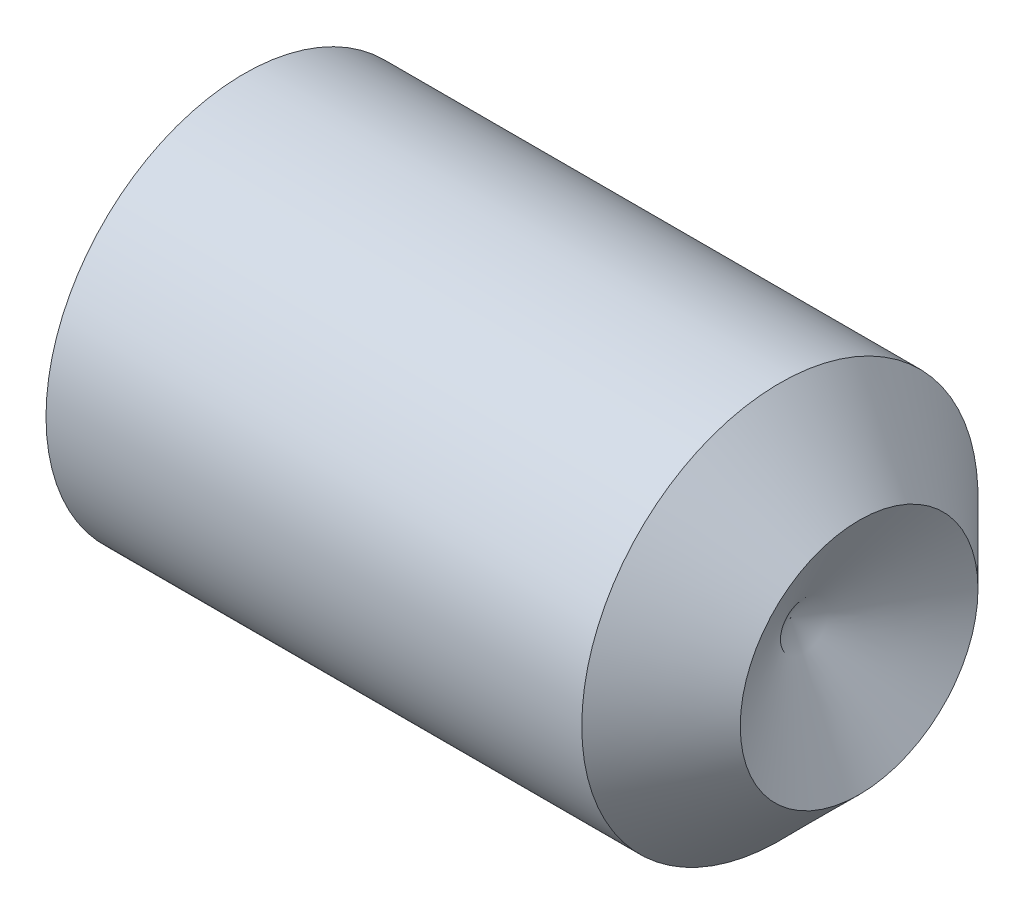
SolidWorks part; units mm, degrees
ref_plane "Plane1" through (0, 0, 0) normal (0, 0, 1) x (1, 0, 0)
ref_plane "Plane2" through (0, 0, 0) normal (0, 1, 0) x (1, 0, 0)
ref_plane "Plane3" through (0, 0, 0) normal (1, 0, 0) x (0, 0, -1)
revolve "BaseBody" add sketch "BodySke" angle 360 about L5
sketch "BodySke" plane through (0, 0, 0) normal (0, 0, 1) x (1, 0, 0)
  line L0 (0, 0) -> (0, 4.172)
  line L1 (0, 4.172) -> (0.478, 5)
  line L2 (0.478, 5) -> (14, 5)
  line L3 (14, 5) -> (16, 3)
  line L4 (14.2679, 0) -> (0, 0)
  line L5 (-12.7, 0) -> (88.9, 0) construction
  line L6 (14.2679, 0) -> (16, 3)
  line L7 (16, 3) -> (16, 12.525) construction
  line L8 (0, -4.172) -> (0.478, -5) construction
  line L9 (14.2679, 0) -> (16, -3) construction
  line L10 (14, -5) -> (16, -3) construction
  line L11 (0.75, 15.875) -> (0.75, -3.175) construction
  dimension "Length" = 16
  dimension "Diameter" = 10
  dimension "Drive_ch_ang" = 60
  dimension "Minor_dia" = 8.344
  dimension "Cup_nose_ang" = 45
  dimension "Cup_ang" = 120
  dimension "Cup_dia" = 6
  dimension "Advance" = 1.5
sketch "Sketch2" plane through (0, 0, 0) normal (-1, 0, 0) x (0, 0, 1)
  line L0 (1.4434, 2.5) -> (-1.4434, 2.5)
  line L1 (-1.4434, 2.5) -> (-2.8868, 0)
  line L2 (1.4434, 2.5) -> (2.8868, 0)
  line L3 (1.4434, -2.5) -> (2.8868, 0)
  line L4 (1.4434, -2.5) -> (-1.4434, -2.5)
  line L5 (-1.4434, -2.5) -> (-2.8868, 0)
  dimension "Hex_size" = 5
  dimension "D2" = 2.5
  dimension "D3" = 2.5
extrude "Hex" cut sketch "Sketch2" against normal blind 6
sketch "ThdSchSke" plane through (0, 0, 0) normal (0, 0, 1) x (1, 0, 0)
  line L0 (0.478, -4.172) -> (-0.1017, -5)
  line L1 (0.478, -4.172) -> (1.0578, -5)
  line L2 (1.0578, -5) -> (1.0578, -6.25)
  line L3 (-3.175, 0) -> (5.1513, 0) construction
  line L4 (0.478, 5) -> (0.478, -5) construction
  line L5 (1.0578, -6.25) -> (-0.1017, -6.25)
  line L6 (-0.1017, -6.25) -> (-0.1017, -5)
  dimension "Thread_minor" = 8.344
  dimension "Diameter" = 10
  dimension "SideAngle" = 55
  dimension "VeeAngle" = 70
  dimension "Overcut" = 12.5
revolve "ThreadSchematic" cut sketch "ThdSchSke" angle 360 about L3
pattern_linear "ThdSchPat"
equation "\"D2@Sketch2\" = \"Hex_size@Sketch2\" / 2"
equation "\"D3@Sketch2\" = \"Hex_size@Sketch2\" / 2"
equation "\"Thread_minor@ThreadCosmetic\" = \"Minor_dia@BodySke\""
equation "\"Thread_minor@ThdSchSke\" = \"Thread_minor@ThreadCosmetic\""
equation "\"Diameter@ThdSchSke\" = \"Diameter@BodySke\""
equation "\"Overcut@ThdSchSke\" = \"Diameter@BodySke\" * 1.25"
equation "\"Num_threads@ThdSchPat\" = int( (\"Length@BodySke\" - ( ( ( \"Diameter@BodySke\" - \"Minor_dia@BodySke\" ) * 0.5 ) / tan( \"Drive_ch_ang@BodySke\" * 0.017453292 ) ) - ( ( ( \"Diameter@BodySke\" - \"Cup_dia@BodySk"
equation "\"Advance@ThdSchPat\" = (\"Length@BodySke\" - ( ( ( \"Diameter@BodySke\" - \"Minor_dia@BodySke\" ) * 0.5 ) / tan( \"Drive_ch_ang@BodySke\" * 0.017453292 ) ) - ( ( ( \"Diameter@BodySke\" - \"Cup_dia@BodySke\" ) * 0."
equation "' \"Num_threads@ThdSchPat\" = \"Num_threads@ThdSchPat\" - sgn( \"Num_threads@ThdSchPat\" - 1) '---chamfered tips only---"
